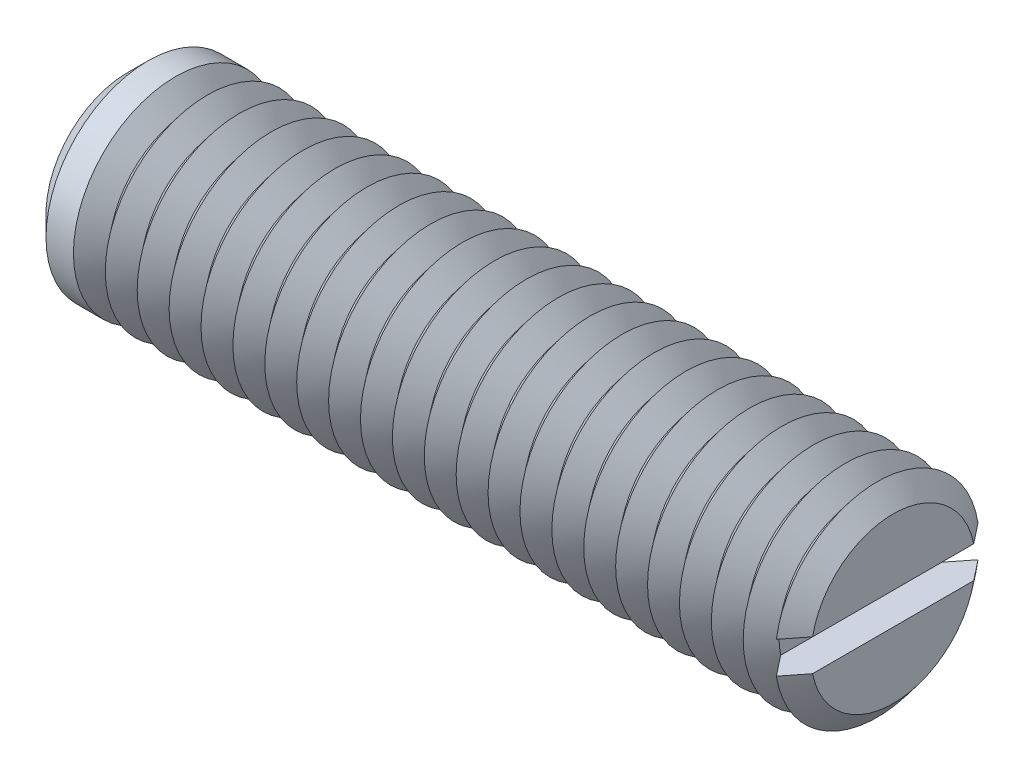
SolidWorks part; units mm, degrees
ref_plane "Front Plane" through (0, 0, 0) normal (0, 0, 1) x (1, 0, 0)
ref_plane "Top Plane" through (0, 0, 0) normal (0, 1, 0) x (1, 0, 0)
ref_plane "Right Plane" through (0, 0, 0) normal (1, 0, 0) x (0, 0, -1)
sketch "Sketch1" plane through (0, 0, 0) normal (1, 0, 0) x (0, 0, -1)
  circle A0 centre (0, 0) radius 4
  dimension "D1" = 8
extrude "Extrude1" add sketch "Sketch1" along normal mid plane 30
sketch "Sketch2" plane through (0, 0, 0) normal (0, 0, 1) x (1, 0, 0)
  line L0 (15, 0.625) -> (13.75, 0.625)
  line L1 (15, -4) -> (15, 4) construction
  line L2 (13.75, 0.625) -> (13.75, -0.625)
  line L3 (0, 0) -> (50000, 0) construction
  line L4 (15, -0.625) -> (13.75, -0.625)
  line L5 (15, -0.625) -> (15, 0.625)
  point P9 (13.75, 0)
  dimension "D1" = 1.25
extrude "Extrude2" cut sketch "Sketch2" against normal mid plane 12
chamfer "Chamfer1" distance 0.8 angle 45 1 edges at (-15, 0, -4)
sketch "Sketch3" plane through (0, 0, 0) normal (0, 0, 1) x (1, 0, 0)
  line L0 (0, 0) -> (30.9602, 0) construction
  line L1 (14.375, -4) -> (15.625, -4)
  line L2 (-14.2, -4) -> (15, -4) construction
  line L3 (15.625, -4) -> (15, -3.2194)
  line L4 (15, -4) -> (15, -0.625) construction
  line L5 (15, -3.2194) -> (14.375, -4)
  dimension "D1" = 1.25
  dimension "D2" = 1
revolve "Cut-Revolve1" cut sketch "Sketch3" angle 360 about L0
pattern_linear "LPattern1" count 23 spacing 1.25 along (-1, 0, 0) of "Cut-Revolve1"
equation "\"D2@Sketch3\" = \"D1@Sketch3\"*0.8"
